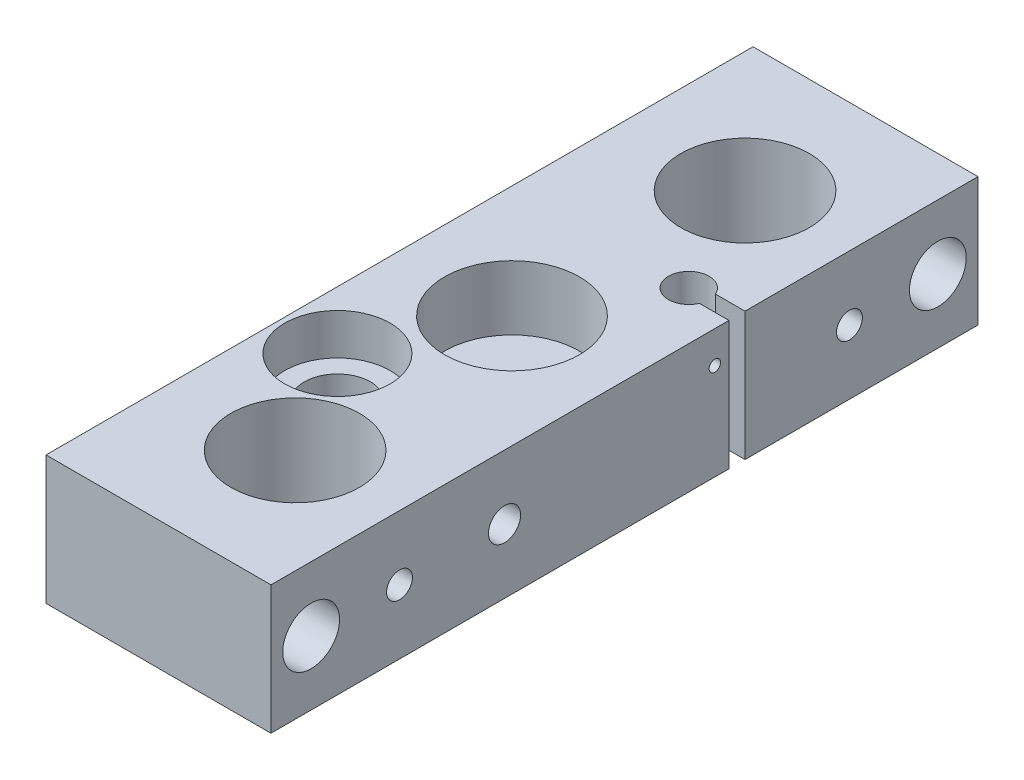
SolidWorks part; units mm, degrees
ref_plane "Front/Back" through (0, 0, 0) normal (0, 0, 1) x (1, 0, 0)
ref_plane "Top/Bottom" through (0, 0, 0) normal (0, 1, 0) x (1, 0, 0)
ref_plane "Right/Left" through (0, 0, 0) normal (1, 0, 0) x (0, 0, -1)
sketch "Sketch1" plane through (0, 0, 0) normal (0, 1, 0) x (1, 0, 0)
  line L0 (0, 0) -> (22.225, 0) construction
  line L1 (-22.225, 69.85) -> (22.225, 69.85)
  line L2 (-22.225, 69.85) -> (-22.225, -69.85)
  line L3 (-22.225, -69.85) -> (22.225, -69.85)
  line L4 (22.225, 69.85) -> (22.225, -69.85)
  line L5 (0, 0) -> (0, 69.85) construction
  dimension "D1" = 44.45
  dimension "D2" = 139.7
extrude "Extrude1" add sketch "Sketch1" along normal mid plane 25.4
sketch "Sketch2" plane through (0, 12.7, 0) normal (0, 1, 0) x (-1, 0, 0)
  line L0 (0, 0) -> (28.5355, 0) construction
  line L1 (0, 0) -> (0, 68.7116) construction
  line L2 (22.225, -69.85) -> (22.225, 69.85) construction
  circle A0 centre (-1.6002, 44.45) radius 12.7
  circle A1 centre (-1.6002, -44.45) radius 12.7
  dimension "D3" = 25.4
  dimension "D1" = 23.8252
  dimension "D2" = 44.45
extrude "Cut-Extrude1" cut sketch "Sketch2" against normal through all
hole_wizard "1/4-20 (Mounting Holes)" positions "Sketch4" profile "Sketch3" tap size "1/4-20" standard "Ansi Inch"
sketch "Sketch4" plane through (22.225, 0, 0) normal (1, 0, 0) x (0, 0, -1)
  line L0 (0, 0) -> (61.5979, 0) construction
  line L1 (-44.45, -12.7) -> (-44.45, 12.7) construction
  line L2 (44.45, -12.7) -> (44.45, 12.7) construction
  point P0 (-44.45, 0)
  point P1 (44.45, 0)
sketch "Sketch3" plane through (22.225, 0, 44.45) normal (0, 1, 0) x (0, 0, -1)
  line L0 (0, 0) -> (0, 7.9248)
  line L1 (0, 7.9248) -> (2.5527, 7.9248)
  line L2 (2.5527, 7.9248) -> (2.5527, 0)
  line L5 (2.5527, 0) -> (0, 0)
  line L11 (0, -6.35) -> (0, 107.95) construction
  dimension "Thru Tap Drill Dia." = 5.1054
  dimension "Thru Tap Drill Depth" = 7.9248
hole_wizard "CBORE for 5/16 Shcs (Mounting Holes)" positions "Sketch6" profile "Sketch5" counterbore size "5/16" standard "Ansi Inch"
sketch "Sketch6" plane through (22.225, 0, 0) normal (1, 0, 0) x (0, 0, -1)
  line L0 (0, 0) -> (0, 22.3919) construction
  line L1 (0, 0) -> (12.7723, 0) construction
  point P0 (61.9125, 0)
  point P1 (-61.9125, 0)
  dimension "D1" = 123.825
sketch "Sketch5" plane through (22.225, 0, -61.9125) normal (0, 1, 0) x (0, 0, -1)
  line L0 (0, 0) -> (0, 44.45)
  line L1 (0, 44.45) -> (4.2164, 44.45)
  line L3 (4.2164, 44.45) -> (4.2164, 7.9375)
  line L4 (4.2164, 7.9375) -> (5.6134, 7.9375)
  line L5 (5.6134, 7.9375) -> (5.6134, 0)
  line L7 (5.6134, 0) -> (0, 0)
  line L11 (0, -6.35) -> (0, 107.95) construction
  dimension "Thru Hole Dia." = 8.4328
  dimension "Thru Hole Depth" = 44.45
  dimension "C'Bore Dia." = 11.2268
  dimension "C'Bore Depth" = 7.9375
sketch "Sketch7" plane through (0, 12.7, 0) normal (0, 1, 0) x (-1, 0, 0)
  line L0 (22.225, -69.85) -> (22.225, 69.85) construction
  line L1 (0, 0) -> (28.8589, 0) construction
  line L2 (0, 0) -> (0, 61.4363) construction
  circle A0 centre (10.795, 23.6982) radius 10.414
  dimension "D1" = 20.828
  dimension "D3" = 23.6982
  dimension "D2" = 11.43
extrude "Cut-Extrude2" cut sketch "Sketch7" against normal blind 8.128
hole_wizard "1/2-20 (Shock Mount)" positions "Sketch9" profile "Sketch8" tap size "9/16-18" standard "Ansi Inch"
sketch "Sketch9" plane through (0, 4.572, 0) normal (0, 1, 0) x (-1, 0, 0)
  point P0 (10.795, 23.6982)
sketch "Sketch8" plane through (-10.795, 4.572, 23.6982) normal (1, 0, 0) x (0, 0, 1)
  line L0 (0, 0) -> (0, 17.272)
  line L1 (0, 17.272) -> (6.5481, 17.272)
  line L2 (6.5481, 17.272) -> (6.5481, 0)
  line L5 (6.5481, 0) -> (0, 0)
  line L11 (0, -6.35) -> (0, 107.95) construction
  dimension "Thru Tap Drill Dia." = 13.0962
  dimension "Thru Tap Drill Depth" = 17.272
sketch "Sketch10" plane through (0, 12.7, 0) normal (0, 1, 0) x (-1, 0, 0)
  circle A0 centre (0, 0) radius 13.335
  dimension "D1" = 26.67
extrude "Cut-Extrude3" cut sketch "Sketch10" against normal blind 12.7
hole_wizard "1/8 NPT (Air Port)" positions "Sketch14" profile "Sketch13" size "1/8" standard "Ansi Inch"
sketch "Sketch14" plane through (0, -12.7, 0) normal (0, -1, 0) x (1, 0, 0)
  point P0 (0, 0)
sketch "Sketch13" plane through (0, -12.7, 0) normal (1, 0, 0) x (0, 0, -1)
  line L0 (0, 0) -> (0, 25.4)
  line L1 (0, 25.4) -> (4.2164, 25.4)
  line L2 (-4.5374, 6.924) -> (-4.7447, 0) construction
  line L3 (4.2164, 25.4) -> (4.2164, 6.924)
  line L4 (4.2164, 6.924) -> (4.5374, 6.924)
  line L5 (4.5374, 6.924) -> (4.7447, 0)
  line L7 (4.7447, 0) -> (0, 0)
  line L8 (0, -6.35) -> (0, 107.95) construction
  line L11 (-4.2164, 6.924) -> (-4.5374, 6.924) construction
  dimension "Thru Tap Drill Dia." = 8.4328
  dimension "Thru Tap Drill Depth" = 25.4
  dimension "Thread Dia." = 9.4894
  dimension "Thread Angle" = 3.43
  dimension "Thread Depth" = 6.924
hole_wizard "#4-40 Tapped Hole1" positions "Sketch16" profile "Sketch15" tap size "#4-40" standard "Ansi Inch"
sketch "Sketch16" plane through (22.225, 0, 0) normal (1, 0, 0) x (0, 0, -1)
  line L0 (-69.85, 12.7) -> (69.85, 12.7) construction
  line L1 (0, 0) -> (0, 23.847) construction
  line L2 (0, 0) -> (0, 12.7) construction
  point P0 (17.8562, 6.35)
  dimension "D1" = 6.35
  dimension "D2" = 17.8562
sketch "Sketch15" plane through (22.225, 6.35, -17.8562) normal (0, 1, 0) x (0, 0, -1)
  line L0 (0, 0) -> (0, 13.5062)
  line L1 (0, 13.5062) -> (1.1303, 12.827)
  line L2 (1.1303, 12.827) -> (1.1303, 0)
  line L5 (1.1303, 0) -> (0, 0)
  line L10 (0, 13.5062) -> (-1.1303, 12.827) construction
  line L11 (0, -6.35) -> (0, 107.95) construction
  dimension "Tap Drill Dia." = 2.2606
  dimension "Tap Drill Depth" = 12.827
  dimension "Drill Angle" = 118
sketch "Sketch17" plane through (0, 12.7, 0) normal (0, 1, 0) x (-1, 0, 0)
  line L0 (22.225, -69.85) -> (22.225, 69.85) construction
  line L1 (-22.225, 69.85) -> (-22.225, -69.85) construction
  line L2 (-22.225, -23.8125) -> (-16.3859, -23.8125)
  line L3 (-22.225, -23.8125) -> (-22.225, -20.6375)
  line L4 (-22.225, -20.6375) -> (-16.3859, -20.6375)
  line L6 (-12.7, -22.225) -> (-17.2873, -22.225) construction
  arc A0 (-16.3859, -23.8125) -> (-16.3859, -20.6375) centre (-12.7, -22.225) ccw
  dimension "D3" = 4.0132
  dimension "D1" = 22.225
  dimension "D2" = 34.925
  dimension "D4" = 3.175
extrude "Cut-Extrude4 (Sensor Mount)" cut sketch "Sketch17" against normal through all
sketch "Sketch18" plane through (22.225, 0, 0) normal (1, 0, 0) x (0, 0, -1)
  line L0 (-69.85, 12.7) -> (20.6375, 12.7) construction
  line L1 (-23.6982, -12.7) -> (-23.6982, 4.572) construction
  circle A0 centre (-23.6982, 0) radius 3.175
  dimension "D1" = 6.35
  dimension "D2" = 12.7
extrude "Cut-Extrude4" cut sketch "Sketch18" against normal blind 15.875
hole_wizard "#10-32 Tapped Hole1" positions "Sketch21" profile "Sketch20" tap size "#10-32" standard "Ansi Inch"
sketch "Sketch21" plane through (6.35, 0, 0) normal (1, 0, 0) x (0, 0, -1)
  point P0 (-23.6982, 0)
sketch "Sketch20" plane through (6.35, 0, 23.6982) normal (0, 1, 0) x (0, 0, -1)
  line L0 (0, 0) -> (0, 10.5969)
  line L1 (0, 10.5969) -> (2.0193, 10.5969)
  line L2 (2.0193, 10.5969) -> (2.0193, 0)
  line L5 (2.0193, 0) -> (0, 0)
  line L11 (0, -6.35) -> (0, 107.95) construction
  dimension "Thru Tap Drill Dia." = 4.0386
  dimension "Thru Tap Drill Depth" = 10.5969
